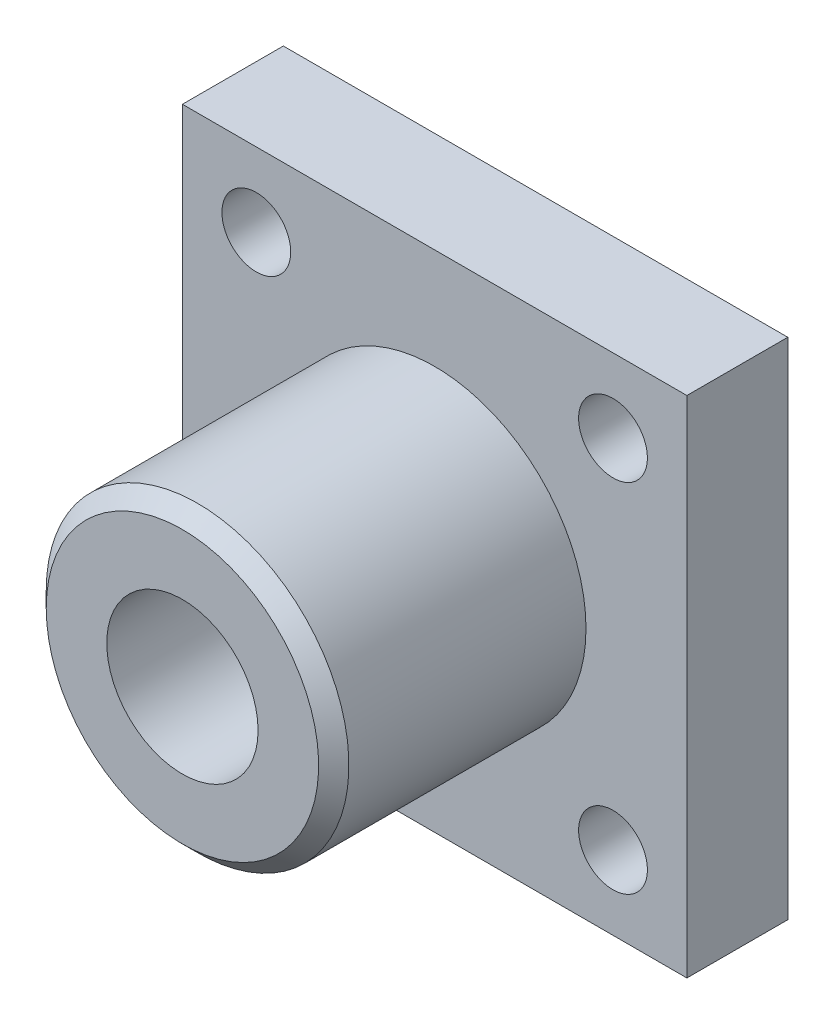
SolidWorks part; units mm, degrees
ref_plane "Front" through (0, 0, 0) normal (0, 0, 1) x (1, 0, 0)
ref_plane "Top" through (0, 0, 0) normal (0, 1, 0) x (1, 0, 0)
ref_plane "Right" through (0, 0, 0) normal (1, 0, 0) x (0, 0, -1)
sketch "Sketch1" plane through (0, 0, 0) normal (0, 0, 1) x (1, 0, 0)
  line L0 (127, -127) -> (-127, 127) construction
  line L1 (-127, 127) -> (127, 127)
  line L2 (-127, 127) -> (-127, -127)
  line L3 (-127, -127) -> (127, -127)
  line L4 (127, 127) -> (127, -127)
  dimension "D1" = 254
extrude "Extrude1" add sketch "Sketch1" along normal blind 50.8
sketch "Sketch2" plane through (0, 0, 50.8) normal (0, 0, 1) x (1, 0, 0)
  line L0 (0, 0) -> (-127, 127) construction
  line L1 (0, 0) -> (127, 127) construction
  line L2 (0, 0) -> (127, -127) construction
  line L3 (0, 0) -> (-127, -127) construction
  circle A0 centre (0, 0) radius 127 construction
  circle A1 centre (89.8026, 89.8026) radius 17.324
  circle A2 centre (-89.8026, 89.8026) radius 17.324
  circle A3 centre (-89.8026, -89.8026) radius 17.324
  circle A4 centre (89.8026, -89.8026) radius 17.324
  dimension "D1" = 254
extrude "Cut-Extrude1" cut sketch "Sketch2" against normal through all
sketch "Sketch3" plane through (0, 0, 50.8) normal (0, 0, 1) x (1, 0, 0)
  circle A0 centre (0, 0) radius 76.2
  dimension "D1" = 152.4
extrude "Extrude2" add sketch "Sketch3" along normal blind 127
chamfer "Chamfer1" distance 7.62 angle 45
sketch "Sketch4" plane through (0, 0, 177.8) normal (0, 0, 1) x (1, 0, 0)
  circle A0 centre (0, 0) radius 38.1
  dimension "D1" = 76.2
extrude "Cut-Extrude2" cut sketch "Sketch4" against normal through all
